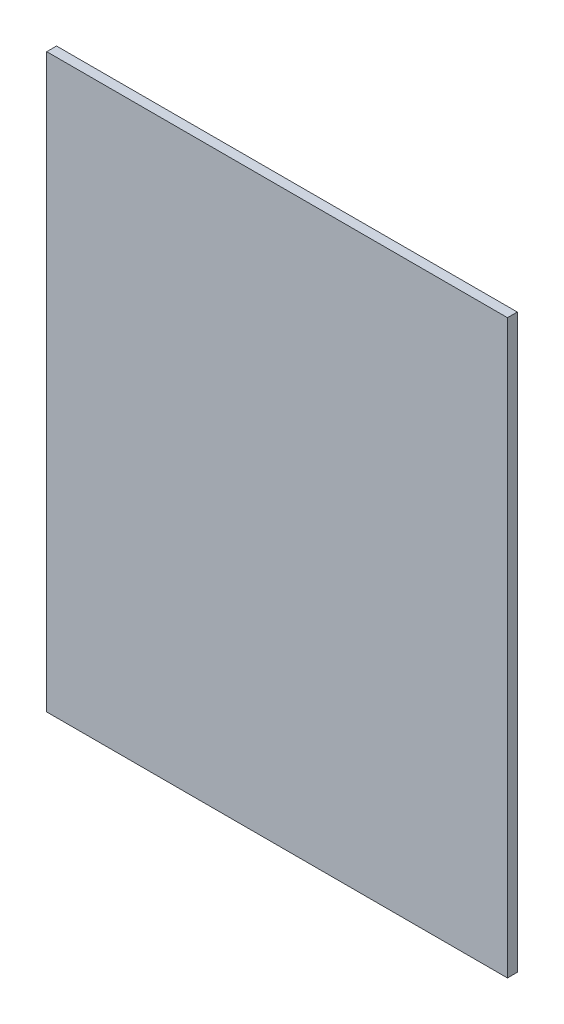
SolidWorks part; units mm, degrees
ref_plane "Front Plane" through (0, 0, 0) normal (0, 0, 1) x (1, 0, 0)
ref_plane "Top Plane" through (0, 0, 0) normal (0, 1, 0) x (1, 0, 0)
ref_plane "Right Plane" through (0, 0, 0) normal (1, 0, 0) x (0, 0, -1)
sketch "Sketch1" plane through (0, 0, 0) normal (0, 0, 1) x (1, 0, 0)
  line L1 (-70.5, -87.5) -> (70.5, -87.5)
  line L2 (-70.5, -87.5) -> (-70.5, 87.5)
  line L3 (-70.5, 87.5) -> (70.5, 87.5)
  line L4 (70.5, -87.5) -> (70.5, 87.5)
  line L5 (-70.5, -87.5) -> (70.5, 87.5) construction
  line L6 (-70.5, 87.5) -> (70.5, -87.5) construction
  point P0 (0, 0)
  dimension "D1" = 141
  dimension "D2" = 175
extrude "Boss-Extrude1" add sketch "Sketch1" along normal blind 3
